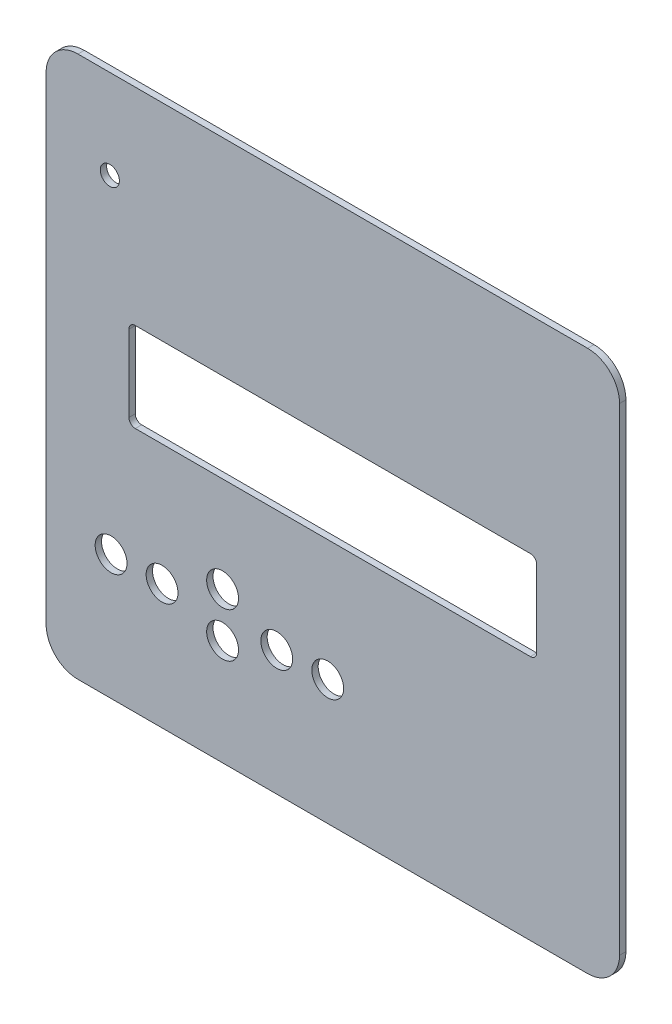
SolidWorks part; units mm, degrees
ref_plane "Спереди" through (0, 0, 0) normal (0, 0, 1) x (1, 0, 0)
ref_plane "Сверху" through (0, 0, 0) normal (0, 1, 0) x (1, 0, 0)
ref_plane "Справа" through (0, 0, 0) normal (1, 0, 0) x (0, 0, -1)
sketch "Эскиз1" plane through (0, 0, 0) normal (0, 0, 1) x (1, 0, 0)
  line L1 (-40, 42.5) -> (40, 42.5)
  line L2 (-45, 37.5) -> (-45, -37.5)
  line L3 (-40, -42.5) -> (40, -42.5)
  line L4 (45, 37.5) -> (45, -37.5)
  line L5 (-45, 42.5) -> (45, -42.5) construction
  line L6 (-45, -42.5) -> (45, 42.5) construction
  arc A0 (40, -42.5) -> (45, -37.5) centre (40, -37.5) ccw
  arc A1 (40, 42.5) -> (45, 37.5) centre (40, 37.5) cw
  arc A2 (-40, 42.5) -> (-45, 37.5) centre (-40, 37.5) ccw
  arc A3 (-45, -37.5) -> (-40, -42.5) centre (-40, -37.5) ccw
  point P0 (0, 0)
  dimension "D3" = 5
  dimension "D1" = 85
  dimension "D2" = 90
extrude "Бобышка-Вытянуть1" add sketch "Эскиз1" along normal blind 1
sketch "Эскиз2" plane through (0, 0, 1) normal (0, 0, 1) x (1, 0, 0)
  line L0 (-31, 10.1) -> (31, 10.1)
  line L1 (-32, 9.1) -> (-32, -2.9)
  line L2 (32, 9.1) -> (32, -2.9)
  line L3 (-31, -3.9) -> (31, -3.9)
  line L4 (-45, 37.5) -> (-45, -37.5) construction
  line L5 (40, 42.5) -> (-40, 42.5) construction
  line L6 (45, -37.5) -> (45, 37.5) construction
  line L7 (-40, -42.5) -> (40, -42.5) construction
  arc A0 (31, 10.1) -> (32, 9.1) centre (31, 9.1) cw
  arc A1 (-32, 9.1) -> (-31, 10.1) centre (-31, 9.1) cw
  arc A2 (31, -3.9) -> (32, -2.9) centre (31, -2.9) ccw
  arc A3 (-32, -2.9) -> (-31, -3.9) centre (-31, -2.9) ccw
  circle A8 centre (-35, 28.5) radius 1.5
  circle A9 centre (-34.8, -22.9) radius 2.5
  circle A10 centre (-26.8, -22.9) radius 2.5
  circle A11 centre (-17.3, -18.9) radius 2.5
  circle A12 centre (-17.3, -25.9) radius 2.5
  circle A13 centre (-8.8, -22.9) radius 2.5
  circle A14 centre (-0.8, -22.9) radius 2.5
  dimension "D1" = 3
  dimension "D2" = 10
  dimension "D3" = 5
  dimension "D9" = 1
  dimension "D4" = 14
  dimension "D5" = 13
  dimension "D6" = 13
  dimension "D7" = 32.4
  dimension "D8" = 38.6
  dimension "D10" = 10.2
  dimension "D11" = 19.6
  dimension "D12" = 18.2
  dimension "D13" = 19.6
  dimension "D14" = 27.7
  dimension "D15" = 23.6
  dimension "D16" = 27.7
  dimension "D17" = 16.6
  dimension "D18" = 36.2
  dimension "D19" = 19.6
  dimension "D20" = 44.2
  dimension "D21" = 19.6
extrude "Вырез-Вытянуть1" cut sketch "Эскиз2" against normal through all
